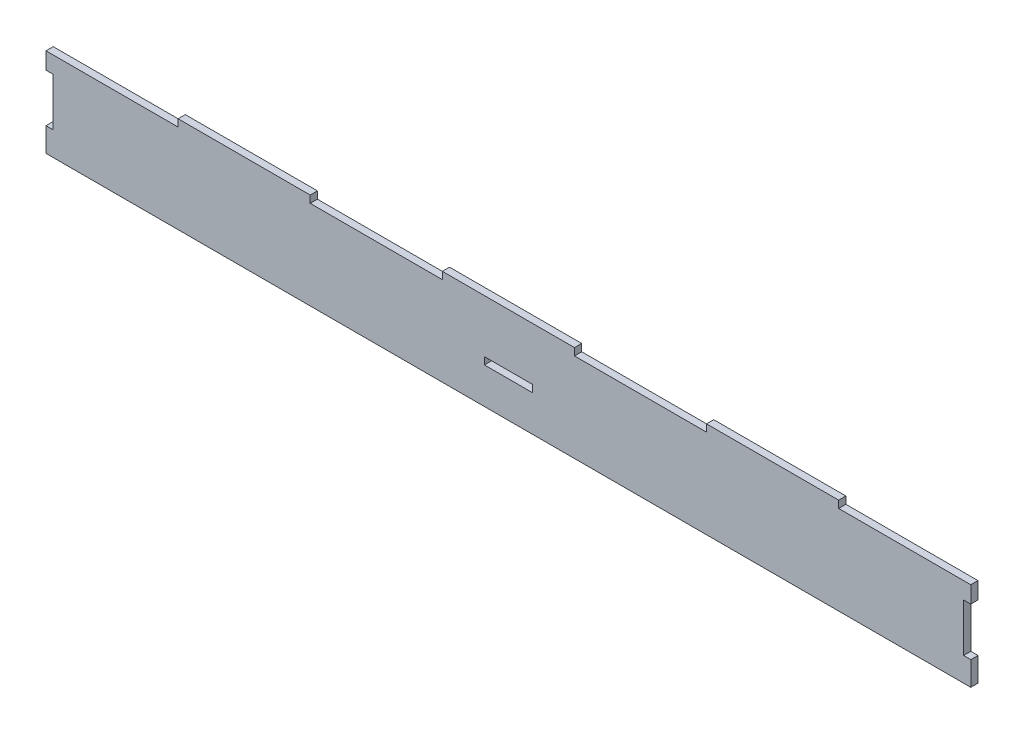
SolidWorks part; units mm, degrees
ref_plane "Plan de face" through (0, 0, 0) normal (0, 0, 1) x (1, 0, 0)
ref_plane "Plan de dessus" through (0, 0, 0) normal (0, 1, 0) x (1, 0, 0)
ref_plane "Plan de droite" through (0, 0, 0) normal (1, 0, 0) x (0, 0, -1)
sketch "Esquisse1" plane through (0, 0, 0) normal (0, 0, 1) x (1, 0, 0)
  line L1 (-192.5, 20) -> (192.5, 20)
  line L2 (-192.5, 20) -> (-192.5, -20)
  line L3 (-192.5, -20) -> (192.5, -20)
  line L4 (192.5, 20) -> (192.5, -20)
  line L5 (-192.5, 20) -> (192.5, -20) construction
  line L6 (-192.5, -20) -> (192.5, 20) construction
  point P0 (0, 0)
  dimension "D1" = 40
  dimension "D2" = 385
extrude "Boss.-Extru.1" add sketch "Esquisse1" along normal blind 3
sketch "Esquisse2" plane through (0, 0, 3) normal (0, 0, 1) x (1, 0, 0)
  line L0 (-82.5, 20) -> (-27.5, 20)
  line L1 (-192.5, 20) -> (-137.5, 20)
  line L2 (-192.5, 20) -> (-192.5, 17)
  line L3 (-192.5, 17) -> (-137.5, 17)
  line L4 (-137.5, 20) -> (-137.5, 17)
  line L5 (-82.5, 20) -> (-82.5, 17)
  line L6 (-82.5, 17) -> (-27.5, 17)
  line L7 (-27.5, 20) -> (-27.5, 17)
  line L8 (27.5, 20) -> (82.5, 20)
  line L9 (27.5, 20) -> (27.5, 17)
  line L10 (27.5, 17) -> (82.5, 17)
  line L11 (82.5, 20) -> (82.5, 17)
  line L12 (137.5, 20) -> (192.5, 20)
  line L13 (137.5, 20) -> (137.5, 17)
  line L14 (137.5, 17) -> (192.5, 17)
  line L15 (192.5, 20) -> (192.5, 17)
  line L16 (-192.5, 0) -> (-142, 0) construction
  line L17 (-192.5, 20) -> (-192.5, -20) construction
  line L18 (0, 0) -> (0, 92.7141) construction
  line L19 (-189.5, 10) -> (-192.5, 10)
  line L20 (-189.5, 10) -> (-189.5, -10)
  line L21 (-189.5, -10) -> (-192.5, -10)
  line L22 (-192.5, 10) -> (-192.5, -10)
  line L23 (-189.5, 10) -> (-192.5, -10) construction
  line L24 (-189.5, -10) -> (-192.5, 10) construction
  line L25 (189.5, -10) -> (192.5, 10) construction
  line L26 (189.5, 10) -> (192.5, -10) construction
  line L27 (192.5, 10) -> (192.5, -10)
  line L28 (189.5, -10) -> (192.5, -10)
  line L29 (189.5, 10) -> (189.5, -10)
  line L30 (189.5, 10) -> (192.5, 10)
  line L32 (-10, -2) -> (10, -2)
  line L33 (-10, -2) -> (-10, -5)
  line L34 (-10, -5) -> (10, -5)
  line L35 (10, -2) -> (10, -5)
  line L36 (-10, -2) -> (10, -5) construction
  line L37 (-10, -5) -> (10, -2) construction
  line L38 (-192.5, -20) -> (192.5, -20) construction
  point P22 (-191, 0)
  point P33 (191, 0)
  point P34 (0, -3.5)
  dimension "D1" = 55
  dimension "D2" = 3
  dimension "D4" = 20
  dimension "D5" = 3
  dimension "D6" = 3
  dimension "D7" = 20
  dimension "D8" = 15
  dimension "D3" = 4
extrude "Enlèv. mat.-Extru.1" cut sketch "Esquisse2" against normal through all
